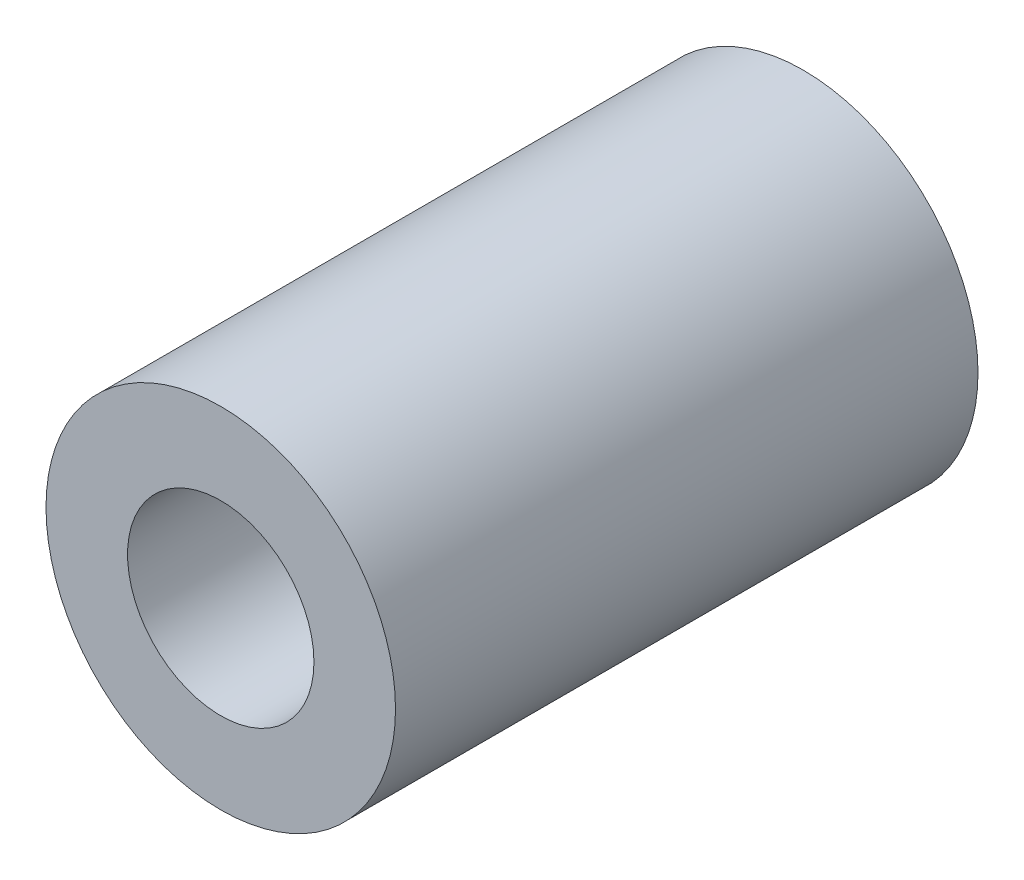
SolidWorks part; units mm, degrees
ref_plane "Frontal" through (0, 0, 0) normal (0, 0, 1) x (1, 0, 0)
ref_plane "Superior" through (0, 0, 0) normal (0, 1, 0) x (1, 0, 0)
ref_plane "Derecha" through (0, 0, 0) normal (1, 0, 0) x (0, 0, -1)
sketch "Croquis1" plane through (0, 0, 0) normal (0, 0, 1) x (1, 0, 0)
  circle A0 centre (0, 0) radius 7.5
  circle A1 centre (0, 0) radius 4
  dimension "D1" = 15
  dimension "D2" = 8
extrude "Extruir1" add sketch "Croquis1" along normal blind 25
